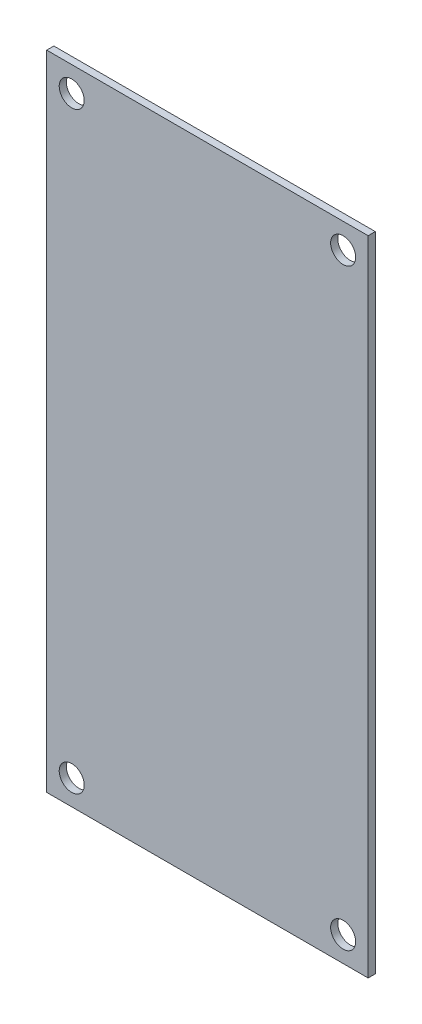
SolidWorks part; units mm, degrees
ref_plane "Front Plane" through (0, 0, 0) normal (0, 0, 1) x (1, 0, 0)
ref_plane "Top Plane" through (0, 0, 0) normal (0, 1, 0) x (1, 0, 0)
ref_plane "Right Plane" through (0, 0, 0) normal (1, 0, 0) x (0, 0, -1)
sketch "Sketch1" plane through (0, 0, 0) normal (0, 0, 1) x (1, 0, 0)
  line L1 (-45, -90) -> (45, -90)
  line L2 (-45, -90) -> (-45, 90)
  line L3 (-45, 90) -> (45, 90)
  line L4 (45, -90) -> (45, 90)
  line L5 (-45, -90) -> (45, 90) construction
  line L6 (-45, 90) -> (45, -90) construction
  point P0 (0, 0)
  dimension "D1" = 90
  dimension "D2" = 180
extrude "Boss-Extrude1" add sketch "Sketch1" along normal blind 2
sketch "Sketch2" plane through (0, 0, 0) normal (0, 0, -1) x (-1, 0, 0)
  line L0 (0, 90) -> (0, -90) construction
  line L1 (-45, 90) -> (45, 90) construction
  line L2 (45, -90) -> (-45, -90) construction
  line L4 (-45, -90) -> (-45, 90) construction
  circle A0 centre (-38, 83) radius 3.5
  circle A1 centre (38, 83) radius 3.5
  point P10 (-45, 81.6283)
  point P11 (0, 0)
  dimension "D1" = 7
  dimension "D2" = 7
  dimension "D3" = 7
extrude "Cut-Extrude1" cut sketch "Sketch2" against normal blind 2
sketch "Sketch3" plane through (0, 0, 0) normal (0, 0, -1) x (-1, 0, 0)
  line L0 (-45, 0) -> (45, 0) construction
  line L1 (-45, -90) -> (-45, 90) construction
  line L2 (45, 90) -> (45, -90) construction
  line L3 (45, -90) -> (-45, -90) construction
  line L4 (0, 0) -> (0, -90) construction
  circle A1 centre (-38, -83) radius 3.5
  circle A2 centre (38, -83) radius 3.5
  dimension "D1" = 7
  dimension "D2" = 7
  dimension "D3" = 7
extrude "Cut-Extrude2" cut sketch "Sketch3" against normal blind 2
